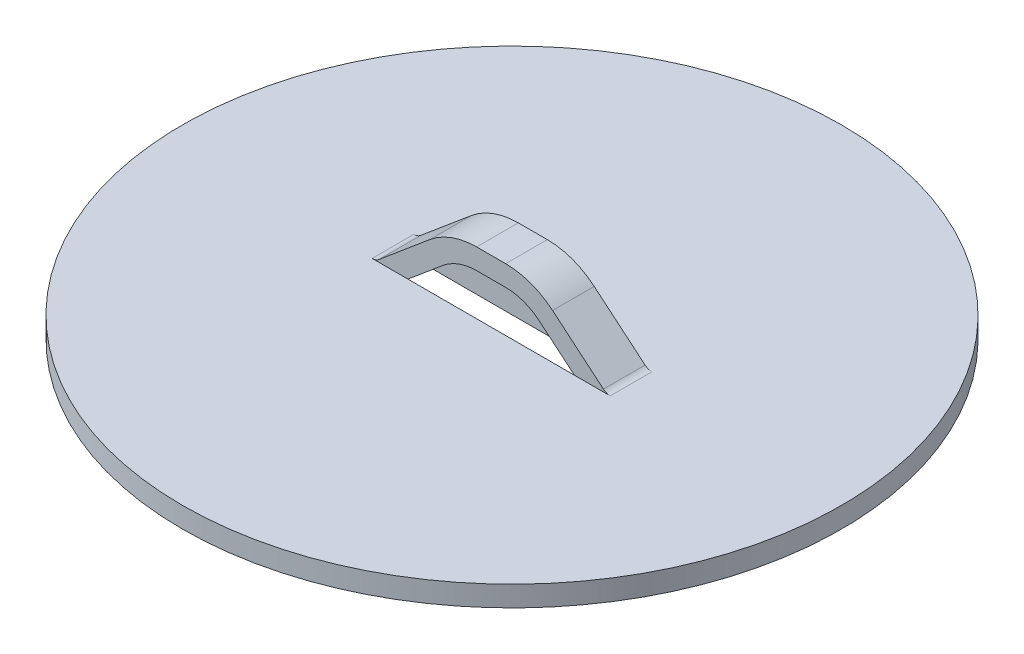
SolidWorks part; units mm, degrees
ref_plane "Front Plane" through (0, 0, 0) normal (0, 0, 1) x (1, 0, 0)
ref_plane "Top Plane" through (0, 0, 0) normal (0, 1, 0) x (1, 0, 0)
ref_plane "Right Plane" through (0, 0, 0) normal (1, 0, 0) x (0, 0, -1)
sketch "Sketch2" plane through (0, 0, 0) normal (0, 0, 1) x (1, 0, 0)
  line L0 (-15.875, 0) -> (-5.7348, 0)
  line L1 (0, 0) -> (0, 13.8293) construction
  line L2 (-5.4083, 0.1188) -> (-2.9581, 2.1748)
  line L3 (-0.6985, 2.9972) -> (0.6985, 2.9972)
  line L4 (2.9581, 2.1748) -> (5.4083, 0.1188)
  line L5 (5.7348, 0) -> (15.875, 0)
  line L6 (-15.875, -0.9906) -> (-5.7348, -0.9906)
  line L7 (-4.7715, -0.64) -> (-2.3214, 1.4159)
  line L8 (-0.6985, 2.0066) -> (0.6985, 2.0066)
  line L9 (2.3214, 1.4159) -> (4.7715, -0.64)
  line L10 (5.7348, -0.9906) -> (15.875, -0.9906)
  line L11 (15.875, 0) -> (15.875, -0.9906)
  line L12 (-15.875, 0) -> (-15.875, -0.9906)
  arc A0 (0.6985, 2.9972) -> (2.9581, 2.1748) centre (0.6985, -0.5181) cw
  arc A1 (-2.9581, 2.1748) -> (-0.6985, 2.9972) centre (-0.6985, -0.5181) cw
  arc A2 (-5.4083, 0.1188) -> (-5.7348, 0) centre (-5.7348, 0.508) cw
  arc A3 (5.4083, 0.1188) -> (5.7348, 0) centre (5.7348, 0.508) ccw
  arc A4 (-4.7715, -0.64) -> (-5.7348, -0.9906) centre (-5.7348, 0.508) cw
  arc A5 (-2.3214, 1.4159) -> (-0.6985, 2.0066) centre (-0.6985, -0.5181) cw
  arc A6 (0.6985, 2.0066) -> (2.3214, 1.4159) centre (0.6985, -0.5181) cw
  arc A7 (4.7715, -0.64) -> (5.7348, -0.9906) centre (5.7348, 0.508) ccw
  point P14 (1.978, 2.9972)
  point P17 (-1.978, 2.9972)
  point P20 (-5.5499, 0)
  point P23 (5.5499, 0)
  dimension "D5" = 0.508
  dimension "D1" = 31.75
  dimension "D2" = 40
  dimension "D3" = 11.0998
  dimension "D4" = 2.9972
  dimension "D6" = 1.397
  dimension "D7" = 0.9906
extrude "Boss-Extrude1" add sketch "Sketch2" along normal blind 2.0066
sketch "Sketch3" plane through (0, -0.9906, 0) normal (0, -1, 0) x (1, 0, 0)
  line L0 (0, 2.0066) -> (0, 0) construction
  line L1 (-5.7348, 2.0066) -> (5.7348, 2.0066)
  line L2 (-5.7348, 2.0066) -> (-5.7348, 0)
  line L3 (-5.7348, 0) -> (5.7348, 0)
  line L4 (5.7348, 2.0066) -> (5.7348, 0)
  circle A0 centre (0, 1.0033) radius 15.875
extrude "Boss-Extrude2" add sketch "Sketch3" against normal up to vertex
other "DeleteFace1"
